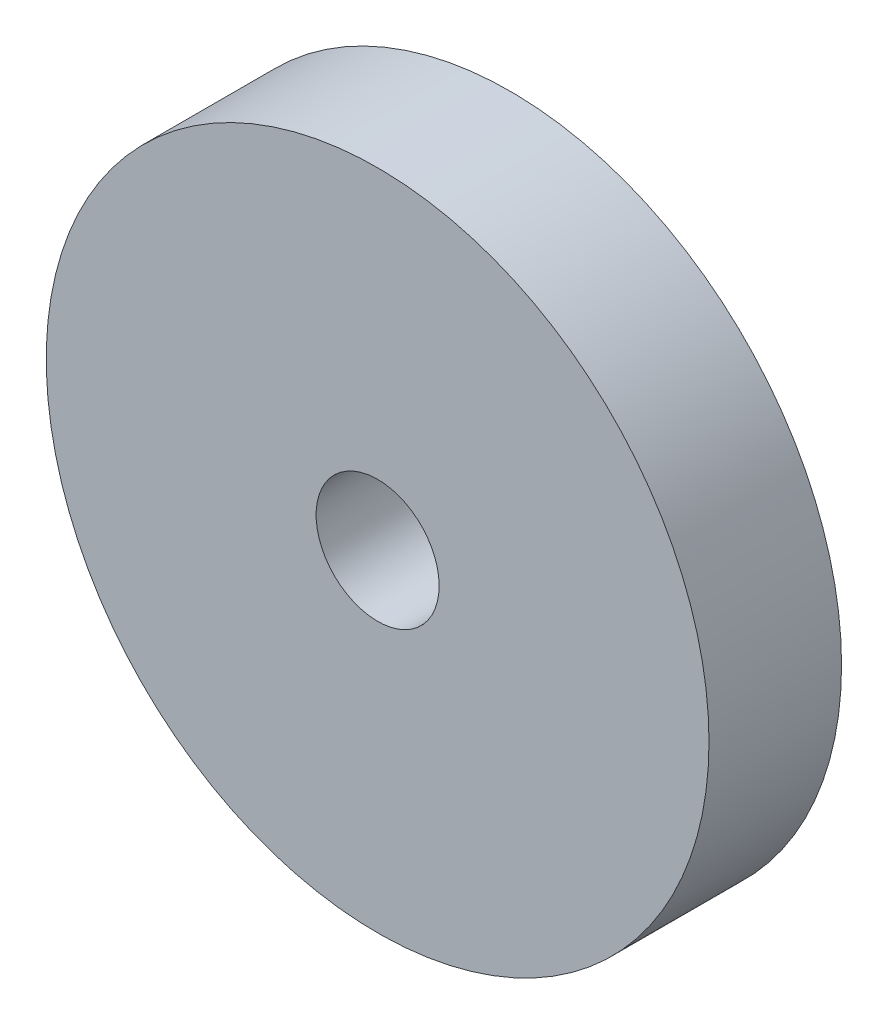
SolidWorks part; units mm, degrees
ref_plane "Front Plane" through (0, 0, 0) normal (0, 0, 1) x (1, 0, 0)
ref_plane "Top Plane" through (0, 0, 0) normal (0, 1, 0) x (1, 0, 0)
ref_plane "Right Plane" through (0, 0, 0) normal (1, 0, 0) x (0, 0, -1)
sketch "Sketch1" plane through (0, 0, 0) normal (0, 0, 1) x (1, 0, 0)
  circle A0 centre (0, 0) radius 7.9375
  dimension "D1" = 15.875
extrude "Boss-Extrude1" add sketch "Sketch1" along normal blind 3.175
hole_wizard "#4 Clearance Hole1" positions "Sketch3" profile "Sketch2" hole size "#4" standard "ANSI Inch"
sketch "Sketch3" plane through (0, 0, 3.175) normal (0, 0, 1) x (1, 0, 0)
  point P0 (0, 0)
sketch "Sketch2" plane through (0, 0, 3.175) normal (1, 0, 0) x (0, -1, 0)
  line L0 (0, 0) -> (0, 3.175)
  line L1 (0, 3.175) -> (1.4732, 3.175)
  line L2 (1.4732, 3.175) -> (1.4732, 0)
  line L5 (1.4732, 0) -> (0, 0)
  line L11 (0, -6.35) -> (0, 107.95) construction
  dimension "Thru Hole Dia." = 2.9464
  dimension "Thru Hole Depth" = 3.175
